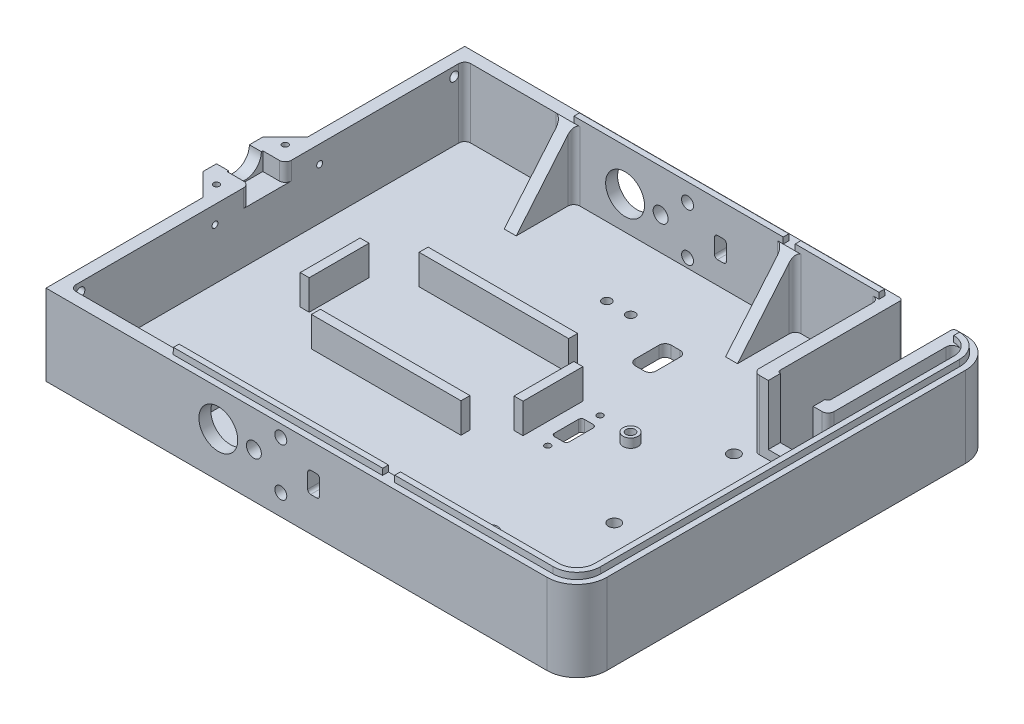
SolidWorks part; units mm, degrees
ref_plane "Front Plane" through (0, 0, 0) normal (0, 0, 1) x (1, 0, 0)
ref_plane "Top Plane" through (0, 0, 0) normal (0, 1, 0) x (1, 0, 0)
ref_plane "Right Plane" through (0, 0, 0) normal (1, 0, 0) x (0, 0, -1)
body saved out of another part "Stock-chassis7-1"
other "Lip&Groove2-Lip" parameters "LipHeight"=2.032, "LipWidth"=2, "LipDraftAngle"=3, "Clearance"=0, "Gap"=0, "upGap"=2.032, "D7"=2, "D8"=3, "D9"=0
fillet "Fillet1" radius 2 16 edges at (-21, -4.4, -66) (-17, -4.4, -66) (53, -4.4, -66) (57, -4.4, -66) (-21, -4.4, 66) (-17, -4.4, 66) (53, -4.4, 66) (57, -4.4, 66) (85, -4.4, -66) (110, -4.4, -24) (85, -4.4, -24) (-53.5, 4.1, 6) (-53.5, 4.1, -6) (-53.5, -4.4, -66) (-53.5, -4.4, 66) (110, -4.4, -66)
fillet "Fillet2" radius 1 4 edges at (89, -6.4, -28) (106, -6.4, -28) (89, -6.4, -70) (106, -6.4, -70)
fillet "Fillet3" radius 2 3 edges at (-57.5, 0.6, 10) (-57.5, 0.6, -10) (-57.5, -2.9, 0)
